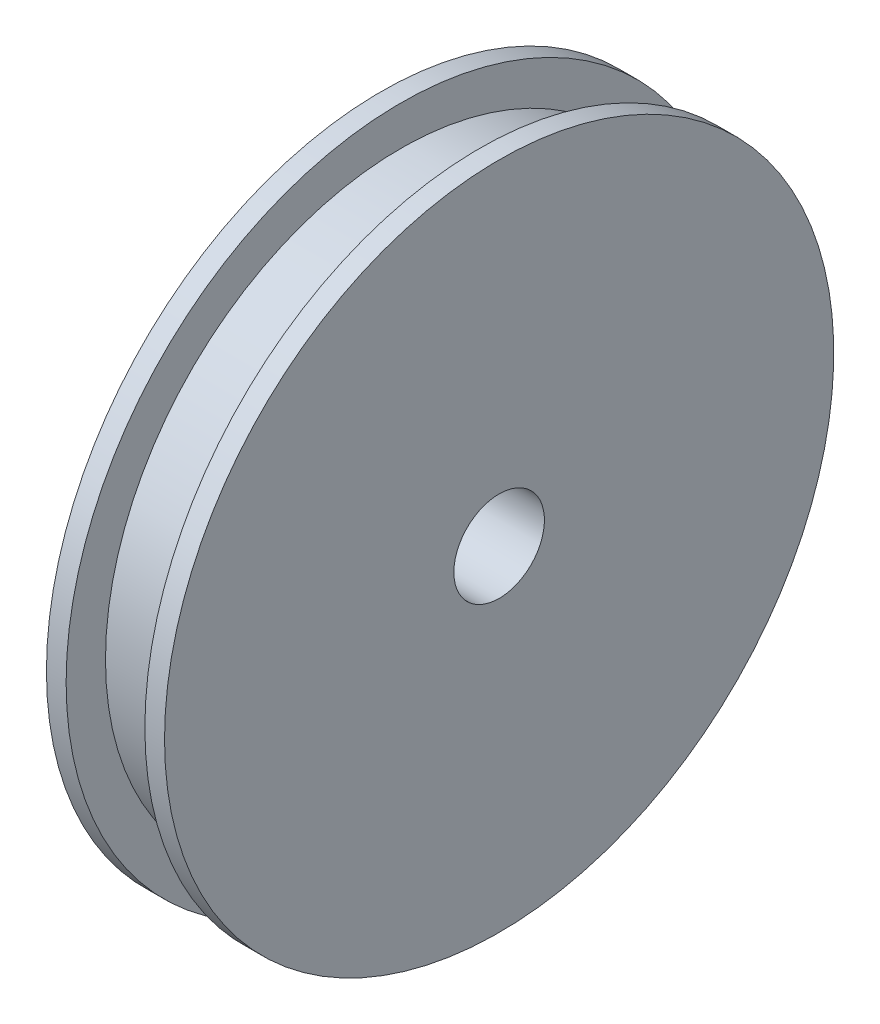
SolidWorks part; units mm, degrees
ref_plane "前视基准面" through (0, 0, 0) normal (0, 0, 1) x (1, 0, 0)
ref_plane "上视基准面" through (0, 0, 0) normal (0, 1, 0) x (1, 0, 0)
ref_plane "右视基准面" through (0, 0, 0) normal (1, 0, 0) x (0, 0, -1)
sketch "草图1" plane through (0, 0, 0) normal (1, 0, 0) x (0, 0, -1)
  circle A0 centre (0, 0) radius 15
  dimension "D1" = 30
extrude "凸台-拉伸1" add sketch "草图1" along normal mid plane 6
sketch "草图2" plane through (-3, 0, 0) normal (-1, 0, 0) x (0, 0, 1)
  circle A0 centre (0, 0) radius 17
  dimension "D1" = 34
extrude "凸台-拉伸2" add sketch "草图2" against normal blind 1
mirror "镜向1" about plane through (0, 0, 0) normal (1, 0, 0) of "凸台-拉伸2"
sketch "草图3" plane through (-3, 0, 0) normal (-1, 0, 0) x (0, 0, 1)
  circle A0 centre (0, 0) radius 4
  dimension "D1" = 8
extrude "凸台-拉伸3" add sketch "草图3" along normal blind 3
sketch "草图4" plane through (-6, 0, 0) normal (-1, 0, 0) x (0, 0, 1)
  circle A0 centre (0, 0) radius 2.3
  dimension "D1" = 4.6
extrude "切除-拉伸1" cut sketch "草图4" against normal through all contours A0
sketch "草图5" plane through (-3, 0, 0) normal (-1, 0, 0) x (0, 0, 1)
  circle A0 centre (0, 0) radius 1.5
  circle A1 centre (0, 0) radius 2.3 construction
  circle A2 centre (0, 0) radius 2.3
  dimension "D1" = 3
extrude "凸台-拉伸4" add sketch "草图5" against normal blind 1
chamfer "倒角1" distance 0.5 angle 45 1 edges at (-6, 0, 2.3)
